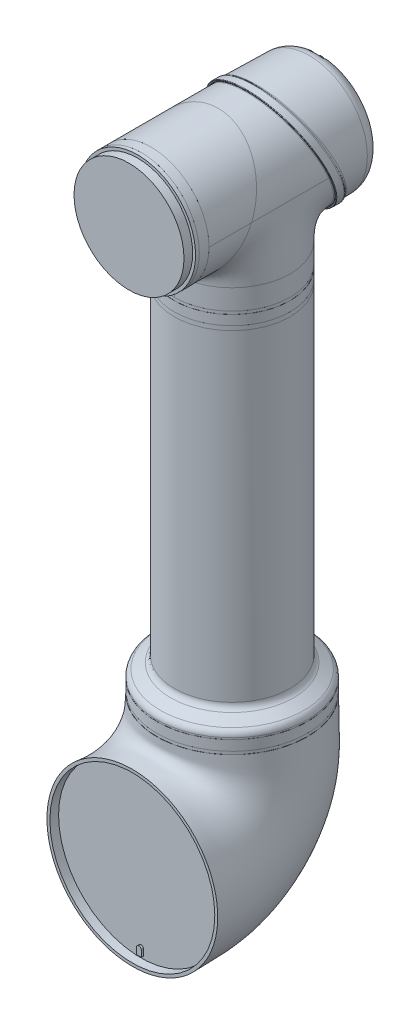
SolidWorks part; units mm, degrees
ref_plane "前视基准面" through (0, 0, 0) normal (0, 0, 1) x (1, 0, 0)
ref_plane "上视基准面" through (0, 0, 0) normal (0, 1, 0) x (1, 0, 0)
ref_plane "右视基准面" through (0, 0, 0) normal (1, 0, 0) x (0, 0, -1)
imported_body "GBT-C5A-300.01-0200_defeature-1-solid1"
imported_body "GBT-C5A-300.02-0301_defeature-1-solid1"
imported_body "GBT-SIZE1.01-T-0200_defeature-1-solid1"
imported_body "GBT-SIZE1.01-T-0200_defeature-1-solid2"
imported_body "GBT-SIZE1.01-T-0200_defeature-1-solid3"
imported_body "SIZE1关节后盖组件-1-solid1"
sketch "草图1" plane through (0, 0, 0) normal (1, 0, 0) x (0, 0, -1)
  line L0 (69, 64) -> (69, 457.5677) construction
  line L1 (19, 64) -> (119, 64) construction
  line L2 (29, 325) -> (109, 325) construction
  line L3 (29, 325) -> (31, 325)
  line L4 (29, 325) -> (29, 318.3)
  line L5 (29, 318.3) -> (31, 318.3)
  line L6 (31, 325) -> (31, 318.3)
  line L7 (109, 318.3) -> (29, 318.3) construction
  line L8 (19, 79) -> (119, 79) construction
  line L9 (17, 79) -> (19, 79)
  line L10 (17, 79) -> (17, 72)
  line L11 (17, 72) -> (19, 72)
  line L12 (19, 79) -> (19, 72)
  line L13 (17, 79) -> (121, 79) construction
  line L14 (121, 72) -> (17, 72) construction
  dimension "D1" = 76
  dimension "D2" = 2
  dimension "D3" = 100
  dimension "D4" = 2
revolve "旋转1" add sketch "草图1" angle 360 about L0
